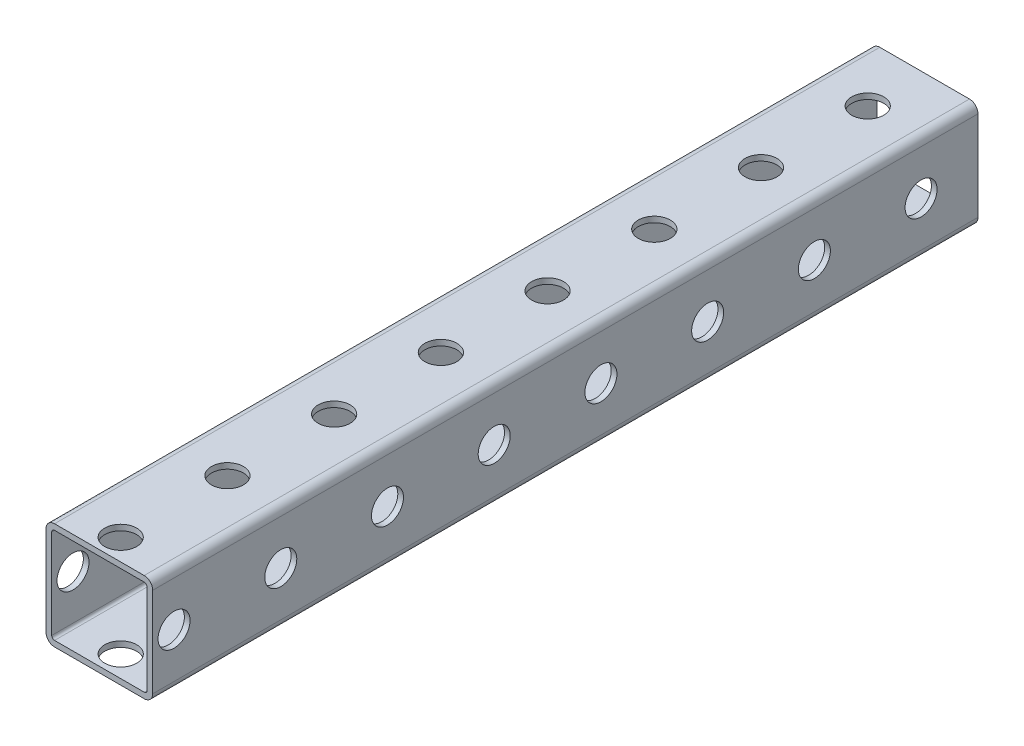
SolidWorks part; units mm, degrees
ref_plane "Front Plane" through (0, 0, 0) normal (0, 0, 1) x (1, 0, 0)
ref_plane "Top Plane" through (0, 0, 0) normal (0, 1, 0) x (1, 0, 0)
ref_plane "Right Plane" through (0, 0, 0) normal (1, 0, 0) x (0, 0, -1)
sketch "Sketch1" plane through (0, 0, 0) normal (0, 0, 1) x (1, 0, 0)
  line L0 (-1.27, 43.815) -> (-1.27, 3.81)
  line L1 (0, 47.625) -> (40.005, 47.625)
  line L2 (-3.81, 43.815) -> (-3.81, 3.81)
  line L3 (0, 0) -> (40.005, 0)
  line L4 (43.815, 43.815) -> (43.815, 3.81)
  line L5 (0, 2.54) -> (40.005, 2.54)
  line L6 (41.275, 43.815) -> (41.275, 3.81)
  line L7 (0, 45.085) -> (40.005, 45.085)
  arc A0 (-3.81, 3.81) -> (0, 0) centre (0, 3.81) ccw
  arc A1 (40.005, 0) -> (43.815, 3.81) centre (40.005, 3.81) ccw
  arc A2 (43.815, 43.815) -> (40.005, 47.625) centre (40.005, 43.815) ccw
  arc A3 (-3.81, 43.815) -> (0, 47.625) centre (0, 43.815) cw
  arc A4 (-1.27, 3.81) -> (0, 2.54) centre (0, 3.81) ccw
  arc A5 (40.005, 2.54) -> (41.275, 3.81) centre (40.005, 3.81) ccw
  arc A6 (41.275, 43.815) -> (40.005, 45.085) centre (40.005, 43.815) ccw
  arc A7 (-1.27, 43.815) -> (0, 45.085) centre (0, 43.815) cw
  point P9 (43.815, 0)
  point P12 (43.815, 47.625)
  point P15 (-3.81, 47.625)
  dimension "D3" = 3.81
  dimension "D1" = 47.625
  dimension "D2" = 47.625
  dimension "D4" = 2.54
extrude "Boss-Extrude1" add sketch "Sketch1" along normal blind 368.3
sketch "Sketch3" plane through (43.815, 0, 0) normal (1, 0, 0) x (0, 0, -1)
  line L0 (0, 23.8125) -> (-101.9827, 23.8125) construction
  line L1 (0, 43.815) -> (0, 3.81) construction
  circle A0 centre (-25.4, 23.8125) radius 7.1438
  dimension "D1" = 14.2875
  dimension "D2" = 25.4
extrude "Cut-Extrude1" cut sketch "Sketch3" against normal through all
sketch "Sketch4" plane through (0, 47.625, 0) normal (0, 1, 0) x (1, 0, 0)
  line L0 (20.0025, 0) -> (20.0025, -173.9135) construction
  line L1 (40.005, 0) -> (0, 0) construction
  circle A0 centre (20.0025, -25.4) radius 7.1438
  dimension "D1" = 14.2875
extrude "Cut-Extrude2" cut sketch "Sketch4" against normal through all
pattern_linear "LPattern1" count 8 spacing 47.625 along (0, 0, 1) of "Cut-Extrude1", "Cut-Extrude2"
